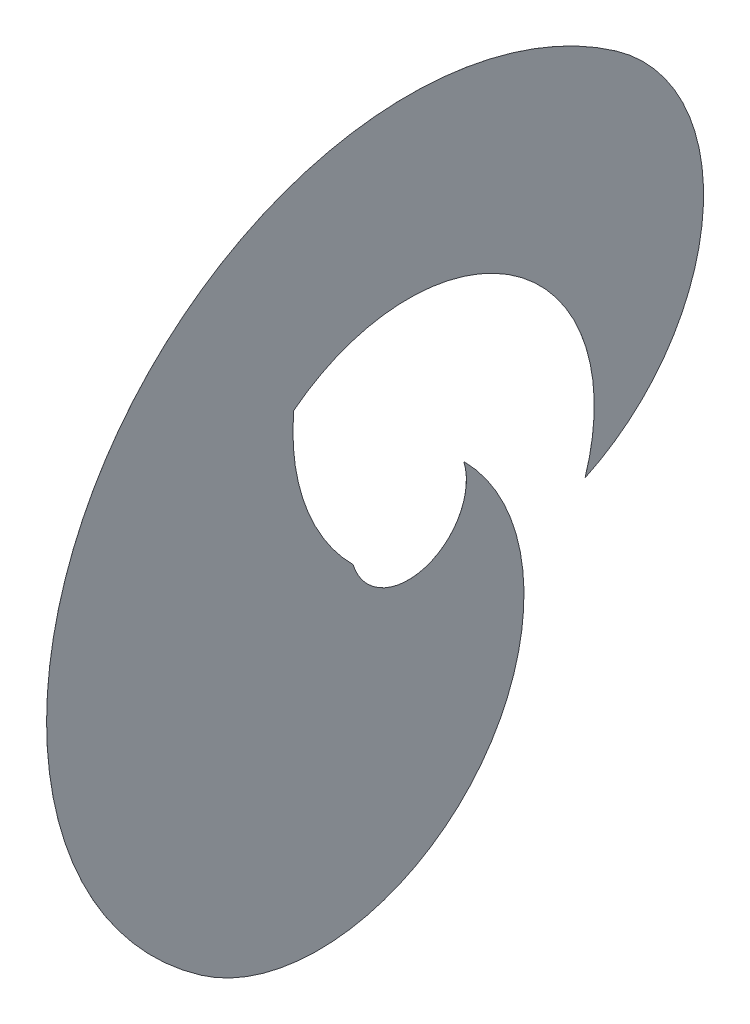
SolidWorks part; units mm, degrees
ref_plane "前视基准面" through (0, 0, 0) normal (0, 0, 1) x (1, 0, 0)
ref_plane "上视基准面" through (0, 0, 0) normal (0, 1, 0) x (1, 0, 0)
ref_plane "右视基准面" through (0, 0, 0) normal (1, 0, 0) x (0, 0, -1)
sketch "草图1" plane through (0, 0, 0) normal (1, 0, 0) x (0, 0, -1)
  line L0 (-250, 657) -> (-250, 1517) construction
  line L1 (-250, 657) -> (243.2757, 1361.4708) construction
  line L2 (-250, 657) -> (-743.2757, -47.4708) construction
  line L3 (-250, 1517) -> (-53.1695, 1552.465) construction
  line L4 (-53.1695, 1552.465) -> (-250, 2644.8741) construction
  line L5 (-250, 2644.8741) -> (-250, 1517) construction
  arc A0 (890.1977, 2285.3711) -> (-1390.1977, -971.3711) centre (-250, 657) ccw
  arc A1 (719.9359, 339.2697) -> (890.1977, 2285.3711) centre (243.2757, 1361.4708) ccw
  arc A2 (-1390.1977, -971.3711) -> (54.2517, 750.0567) centre (-743.2757, -47.4708) ccw
  arc A3 (54.2517, 750.0567) -> (-554.2517, 563.9433) centre (-250, 657) cw
  arc A4 (719.9359, 339.2697) -> (-880.3065, 1459.7715) centre (-250, 657) ccw
  arc A5 (-880.3065, 1459.7715) -> (-554.2517, 563.9433) centre (243.2757, 1361.4708) ccw
  point P0 (-250, 657)
  dimension "D4" = 200
  dimension "D1" = 250
  dimension "D2" = 657
  dimension "D3" = 860
  dimension "D5" = 35
  dimension "D6" = 145
  dimension "D7" = 860
  dimension "D8" = 860
  dimension "D9" = 120
  dimension "D10" = 170
  dimension "D11" = 1110
extrude "凸台-拉伸1" add sketch "草图1" along normal blind 0.1
